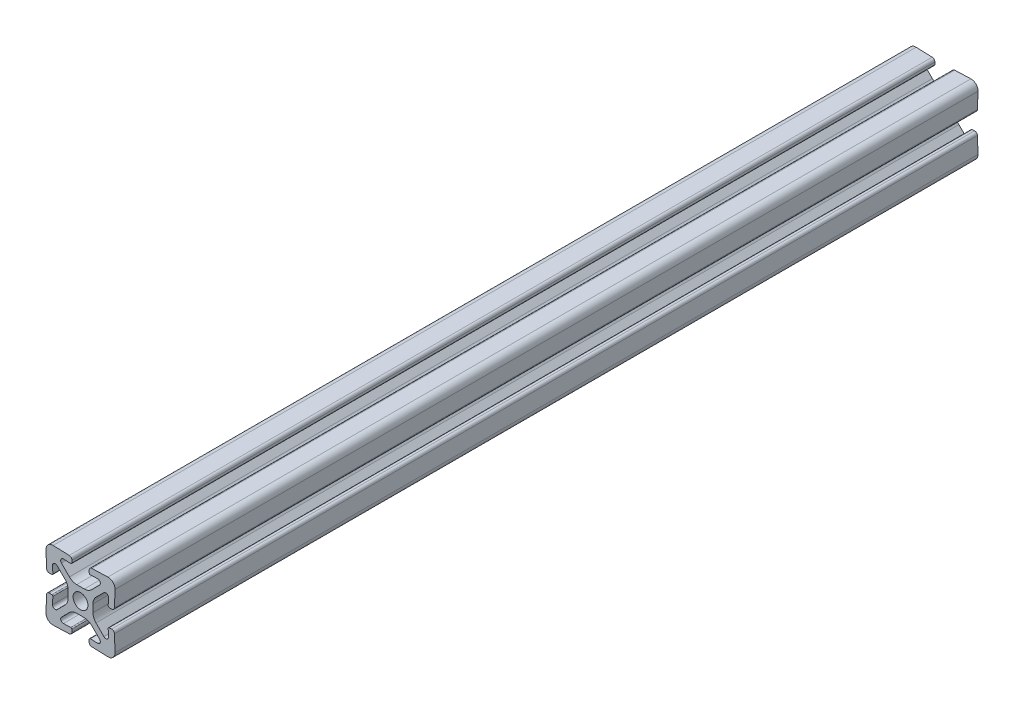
SolidWorks part; units mm, degrees
ref_plane "Front Plane" through (0, 0, 0) normal (0, 0, 1) x (1, 0, 0)
ref_plane "Top Plane" through (0, 0, 0) normal (0, 1, 0) x (1, 0, 0)
ref_plane "Right Plane" through (0, 0, 0) normal (1, 0, 0) x (0, 0, -1)
sketch "Sketch1" plane through (0, 0, 0) normal (0, 0, 1) x (1, 0, 0)
  line L0 (0, 0) -> (0, 10) construction
  line L1 (0, 0) -> (10, 0) construction
  line L2 (0, 0) -> (-10, 10) construction
  line L3 (-7.9302, 9.9988) -> (-3.2721, 9.8361)
  line L4 (-10, 10) -> (0, 10) construction
  line L6 (-2.8352, 8.0198) -> (-4.953, 8.0937)
  line L10 (0, 3.6) -> (-1.1022, 3.6)
  line L11 (-3.2236, 4.4787) -> (-5.5244, 6.7796)
  line L24 (0, 0) -> (-10, 0) construction
  line L25 (-10, 0) -> (0, 0) construction
  line L26 (0, 0) -> (0, -10) construction
  line L27 (-10, -10) -> (-10, 10) construction
  line L28 (0, 10) -> (10, 10) construction
  line L29 (-2.5249, 8.3091) -> (-2.5005, 9.0087)
  line L30 (-10, -10) -> (10, -10) construction
  arc A0 (-9.4142, 9.4142) -> (-7.9302, 9.9988) centre (-8, 8) cw
  arc A5 (-3.2721, 9.8361) -> (-2.5005, 9.0087) centre (-3.3, 9.0366) cw
  arc A6 (-1.1022, 3.6) -> (-3.2236, 4.4787) centre (-1.1022, 6.6) cw
  circle A16 centre (0, 0) radius 2.15
  arc A18 (-5.5244, 6.7796) -> (-4.953, 8.0937) centre (-4.9799, 7.3241) cw
  arc A20 (-2.8352, 8.0198) -> (-2.5249, 8.3091) centre (-2.8247, 8.3196) ccw
  point P15 (0, 0)
  point P42 (-2.3449, 3.6)
  point P80 (-10, 0)
  point P85 (0, -10)
  point P88 (0, -10)
sketch "Sketch2" plane through (0, 0, 0) normal (1, 0, 0) x (0, 0, -1)
  line L0 (-152.4, 0) -> (152.4, 0)
  line L1 (-152.4, -10) -> (-152.4, 10)
  line L2 (0, 0) -> (0, 10) construction
  line L3 (0, 0) -> (0, 10) construction
  line L4 (152.4, -10) -> (152.4, 10)
  point P0 (-122.4, 0)
  point P3 (0, 0)
  point P7 (122.4, 0)
  point P11 (-152.4, 0)
  point P14 (152.4, 0)
sketch "Sketch3" plane through (0, 0, 0) normal (0, 0, 1) x (1, 0, 0)
  line L0 (-2.5249, 8.3091) -> (-2.5005, 9.0087) construction
  line L1 (0, 0) -> (-10, 10) construction
  line L2 (0, 0) -> (-10, 10) construction
  line L5 (-7.9302, 9.9988) -> (-3.2721, 9.8361) construction
  line L6 (-2.8352, 8.0198) -> (-4.953, 8.0937) construction
  line L17 (-2.5249, 8.3091) -> (-2.5005, 9.0087)
  line L19 (-2.8352, 8.0198) -> (-4.953, 8.0937)
  line L20 (0, 0) -> (0, 10) construction
  line L21 (-3.6, 0) -> (-2.15, 0)
  line L22 (-3.6, 0) -> (-3.6, 1.1022)
  line L23 (-4.4787, 3.2236) -> (-6.7796, 5.5244)
  line L42 (-3.2236, 4.4787) -> (-5.5244, 6.7796) construction
  line L43 (0, 3.6) -> (-1.1022, 3.6) construction
  line L44 (-7.9302, 9.9988) -> (-3.2721, 9.8361)
  line L47 (-3.2236, 4.4787) -> (-5.5244, 6.7796)
  line L48 (0, 3.6) -> (-1.1022, 3.6)
  line L59 (0, 3.6) -> (0, 2.15)
  line L60 (-9.9988, 7.9302) -> (-9.8361, 3.2721)
  line L61 (-8.0198, 2.8352) -> (-8.0937, 4.953)
  line L62 (-8.3091, 2.5249) -> (-9.0087, 2.5005)
  arc A0 (-7.9302, 9.9988) -> (-9.4142, 9.4142) centre (-8, 8) ccw construction
  arc A1 (-2.8352, 8.0198) -> (-2.5249, 8.3091) centre (-2.8247, 8.3196) ccw construction
  arc A3 (-2.8352, 8.0198) -> (-2.5249, 8.3091) centre (-2.8247, 8.3196) ccw
  arc A5 (-7.9302, 9.9988) -> (-9.9988, 7.9302) centre (-8, 8) ccw
  circle A13 centre (0, 0) radius 2.15 construction
  arc A14 (0, 2.15) -> (-2.15, 0) centre (0, 0) ccw
  arc A15 (-4.4787, 3.2236) -> (-3.6, 1.1022) centre (-6.6, 1.1022) cw
  arc A16 (-8.0937, 4.953) -> (-6.7796, 5.5244) centre (-7.3241, 4.9799) cw
  arc A17 (-9.0087, 2.5005) -> (-9.8361, 3.2721) centre (-9.0366, 3.3) cw
  arc A18 (-8.0198, 2.8352) -> (-8.3091, 2.5249) centre (-8.3196, 2.8247) cw
  arc A36 (-2.5005, 9.0087) -> (-3.2721, 9.8361) centre (-3.3, 9.0366) ccw construction
  arc A38 (-4.953, 8.0937) -> (-5.5244, 6.7796) centre (-4.9799, 7.3241) ccw construction
  arc A39 (-3.2236, 4.4787) -> (-1.1022, 3.6) centre (-1.1022, 6.6) ccw construction
  arc A41 (-2.5005, 9.0087) -> (-3.2721, 9.8361) centre (-3.3, 9.0366) ccw
  arc A43 (-4.953, 8.0937) -> (-5.5244, 6.7796) centre (-4.9799, 7.3241) ccw
  arc A44 (-3.2236, 4.4787) -> (-1.1022, 3.6) centre (-1.1022, 6.6) ccw
extrude "Boss-Extrude1" add sketch "Sketch3" along normal mid plane 250
pattern_circular "CirPattern1" count 4 over 360 about axis through (0, 0, 0) along (0, 0, 1) of "Boss-Extrude1"
ref_plane "Contact Plane 1" through (0, 10, 0) normal (0, 1, 0) x (1, 0, 0)
ref_plane "Contact Plane 2" through (10, 0, 0) normal (1, 0, 0) x (0, 0, -1)
ref_plane "Contact Plane 3" through (0, -10, 0) normal (0, -1, 0) x (-1, 0, 0)
ref_plane "Contact Plane 4" through (-10, 0, 0) normal (-1, 0, 0) x (0, 0, 1)
equation "\"D1@Sketch2\"=\"Rail Width@Sketch1\"*1.5"
equation "\"D1@Boss-Extrude1\" = \"Representative Length@Sketch2\""
